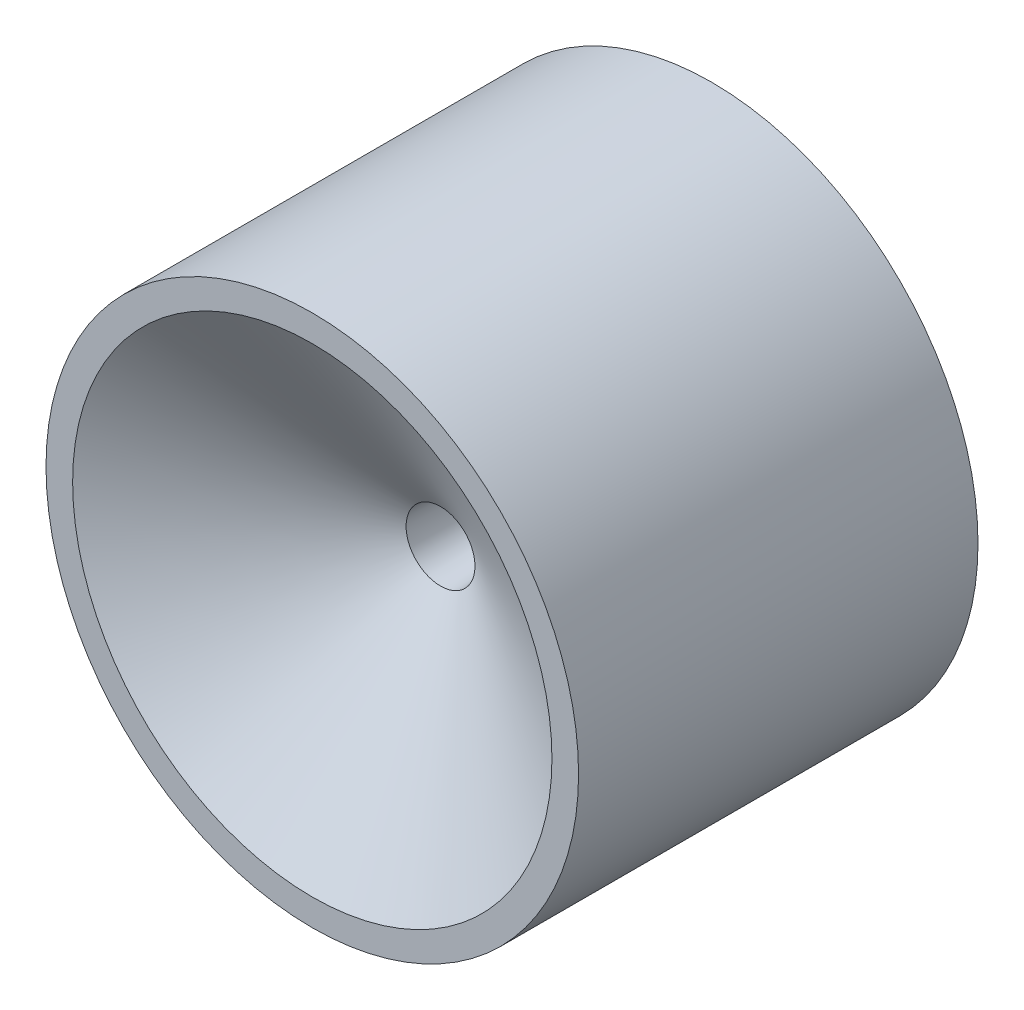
SolidWorks part; units mm, degrees
ref_plane "Plan de face" through (0, 0, 0) normal (0, 0, 1) x (1, 0, 0)
ref_plane "Plan de dessus" through (0, 0, 0) normal (0, 1, 0) x (1, 0, 0)
ref_plane "Plan de droite" through (0, 0, 0) normal (1, 0, 0) x (0, 0, -1)
sketch "Esquisse1" plane through (0, 0, 0) normal (0, 0, 1) x (1, 0, 0)
  circle A0 centre (0, 0) radius 10
  dimension "D1" = 20
extrude "Boss.-Extru.1" add sketch "Esquisse1" along normal blind 15
sketch "Esquisse2" plane through (0, 0, 0) normal (0, 0, 1) x (1, 0, 0)
  circle A0 centre (0, 0) radius 3.4
  dimension "D1" = 6.8
extrude "Enlèv. mat.-Extru.1" cut sketch "Esquisse2" along normal blind 8
sketch "Esquisse3" plane through (0, 0, 8) normal (0, 0, -1) x (-1, 0, 0)
  circle A0 centre (0, 0) radius 1.2
  dimension "D1" = 2.4
extrude "Enlèv. mat.-Extru.2" cut sketch "Esquisse3" against normal through all draft 2.45
sketch "Esquisse5" plane through (0, 0, 15) normal (0, 0, 1) x (1, 0, 0)
  circle A0 centre (0, 0) radius 9
  dimension "D1" = 18
extrude "Enlèv. mat.-Extru.3" cut sketch "Esquisse5" against normal blind 5 draft 58
sketch "Esquisse6" plane through (0, 0, 0) normal (0, 0, -1) x (-1, 0, 0)
  circle A0 centre (0, 0) radius 9
  circle A1 centre (0, 0) radius 5.5
  dimension "D1" = 18
  dimension "D2" = 11
extrude "Enlèv. mat.-Extru.4" cut sketch "Esquisse6" against normal blind 12
